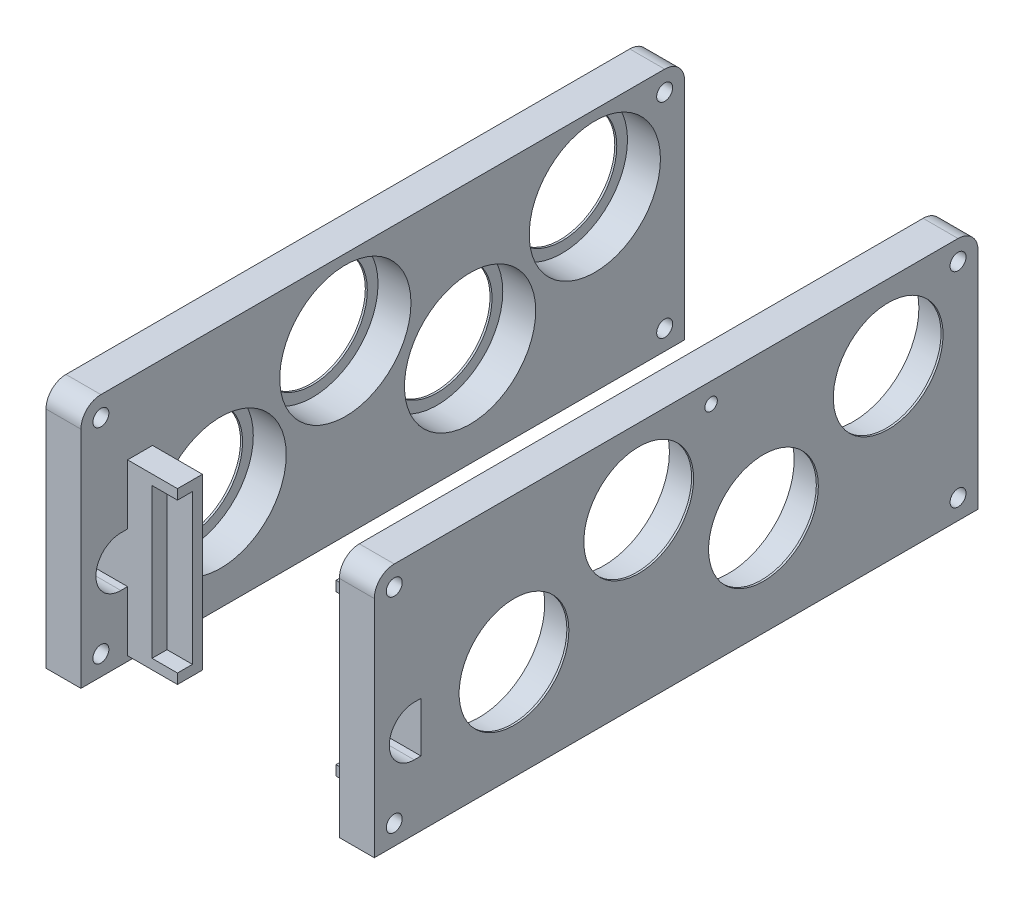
SolidWorks part; units mm, degrees
ref_plane "Front Plane" through (0, 0, 0) normal (0, 0, 1) x (1, 0, 0)
ref_plane "Top Plane" through (0, 0, 0) normal (0, 1, 0) x (1, 0, 0)
ref_plane "Right Plane" through (0, 0, 0) normal (1, 0, 0) x (0, 0, -1)
sketch "Sketch1" plane through (0, 0, 0) normal (1, 0, 0) x (0, 0, -1)
  line L0 (0, 20) -> (28, 20) construction
  line L1 (0, 0) -> (121, 0)
  line L2 (0, 0) -> (0, 49)
  line L3 (0, 49) -> (121, 49)
  line L4 (121, 0) -> (121, 49)
  line L5 (0, 33.85) -> (53, 33.85) construction
  line L6 (53, 33.85) -> (103, 33.85) construction
  line L7 (103, 33.85) -> (121, 33.85) construction
  line L8 (28, 20) -> (78, 20) construction
  line L9 (78, 20) -> (121, 20) construction
  circle A5 centre (28, 20) radius 13.15
  circle A6 centre (78, 20) radius 13.15
  circle A7 centre (53, 33.85) radius 13.15
  circle A8 centre (103, 33.85) radius 13.15
  point P5 (53, 20)
  point P20 (78, 33.85)
  point P21 (28, 6.85)
  dimension "D1" = 26.3
  dimension "D2" = 28
  dimension "D3" = 50
  dimension "D4" = 18
  dimension "D5" = 20
  dimension "D6" = 15.15
  dimension "D7" = 49
extrude "Boss-Extrude1" add sketch "Sketch1" along normal blind 7
sketch "Sketch2" plane through (7, 0, 0) normal (1, 0, 0) x (0, 0, -1)
  line L1 (0, 49) -> (121, 49)
  line L2 (0, 49) -> (0, 0)
  line L3 (0, 0) -> (121, 0)
  line L4 (121, 49) -> (121, 0)
  circle A0 centre (28, 20) radius 11
  circle A1 centre (53, 33.85) radius 11
  circle A2 centre (78, 20) radius 11
  circle A3 centre (103, 33.85) radius 11
  dimension "D1" = 22
extrude "Boss-Extrude2" add sketch "Sketch2" against normal blind 0.4
sketch "Sketch3" plane through (0, 0, 0) normal (-1, 0, 0) x (0, 0, 1)
  line L0 (-9.35, 3) -> (-12.35, 3)
  line L1 (-12.35, 3) -> (-12.35, 33)
  line L2 (-9.35, 3) -> (-9.35, 1)
  line L3 (-9.35, 1) -> (-14.35, 1)
  line L4 (-14.35, 1) -> (-14.35, 35)
  line L5 (-14.35, 35) -> (-9.35, 35)
  line L6 (-9.35, 35) -> (-9.35, 33)
  line L7 (-9.35, 33) -> (-12.35, 33)
  line L8 (0, 0) -> (-121, 0) construction
  line L9 (-41.15, 20) -> (-14.85, 20) construction
  circle A4 centre (-28, 20) radius 13.15 construction
  circle A5 centre (-28, 20) radius 13.15 construction
  dimension "D1" = 30
  dimension "D2" = 1
  dimension "D3" = 2
  dimension "D4" = 3
  dimension "D5" = 0.5
  dimension "D6" = 2
extrude "Boss-Extrude3" add sketch "Sketch3" along normal blind 10
sketch "Sketch4" plane through (0, 0, 0) normal (-1, 0, 0) x (0, 0, 1)
  line L1 (-9.35, 33) -> (-12.35, 33)
  line L2 (-9.35, 33) -> (-9.35, 3)
  line L3 (-9.35, 3) -> (-12.35, 3)
  line L4 (-12.35, 33) -> (-12.35, 3)
extrude "Boss-Extrude4" add sketch "Sketch4" along normal blind 4.9
sketch "Sketch5" plane through (0, 0, 0) normal (-1, 0, 0) x (0, 0, 1)
  line L0 (-9.35, 1) -> (-9.35, 35) construction
  line L1 (-9.35, 23) -> (-8, 23)
  line L2 (-9.35, 23) -> (-9.35, 13)
  line L3 (-9.35, 13) -> (-8, 13)
  line L4 (-8, 23) -> (-8, 13) construction
  line L5 (-9.35, 3) -> (-9.35, 33) construction
  line L6 (0, 49) -> (0, 0) construction
  arc A0 (-8, 23) -> (-8, 13) centre (-8, 18) cw
  point P8 (-9.35, 18)
  point P9 (-8, 18)
  point P12 (-3, 18)
  dimension "D1" = 10
  dimension "D2" = 3
extrude "Cut-Extrude1" cut sketch "Sketch5" against normal through all
ref_plane "Mid plane" through (-25.9, 0, 0) normal (-1, 0, 0) x (0, 0, 1)
fillet "Fillet1" radius 4 2 edges at (3.5, 49, -121) (3.5, 49, 0)
sketch "Sketch7" plane through (7, 0, 0) normal (1, 0, 0) x (0, 0, -1)
  line L0 (4, 45) -> (117, 45) construction
  line L1 (60.5, 49) -> (60.5, 0) construction
  line L2 (117, 49) -> (4, 49) construction
  line L3 (0, 0) -> (121, 0) construction
  line L4 (60.5, 24.5) -> (0, 24.5) construction
  line L5 (0, 45) -> (0, 0) construction
  circle A0 centre (4, 45) radius 1.6
  circle A1 centre (117, 45) radius 1.6
  circle A2 centre (67.5, 45) radius 1.25
  circle A3 centre (117, 4) radius 1.6
  circle A4 centre (4, 4) radius 1.6
  dimension "D1" = 3.2
  dimension "D2" = 2.5
  dimension "D3" = 7
extrude "Cut-Extrude2" cut sketch "Sketch7" against normal through all
sketch "Sketch8" plane through (0, 0, 0) normal (-1, 0, 0) x (0, 0, 1)
  circle A0 centre (-67.5, 45) radius 1.25 construction
  circle A1 centre (-67.5, 45) radius 1.25
extrude "Boss-Extrude5" add sketch "Sketch8" against normal blind 0.5
mirror "Mirror2" about plane through (-25.9, 0, 0) normal (-1, 0, 0)
